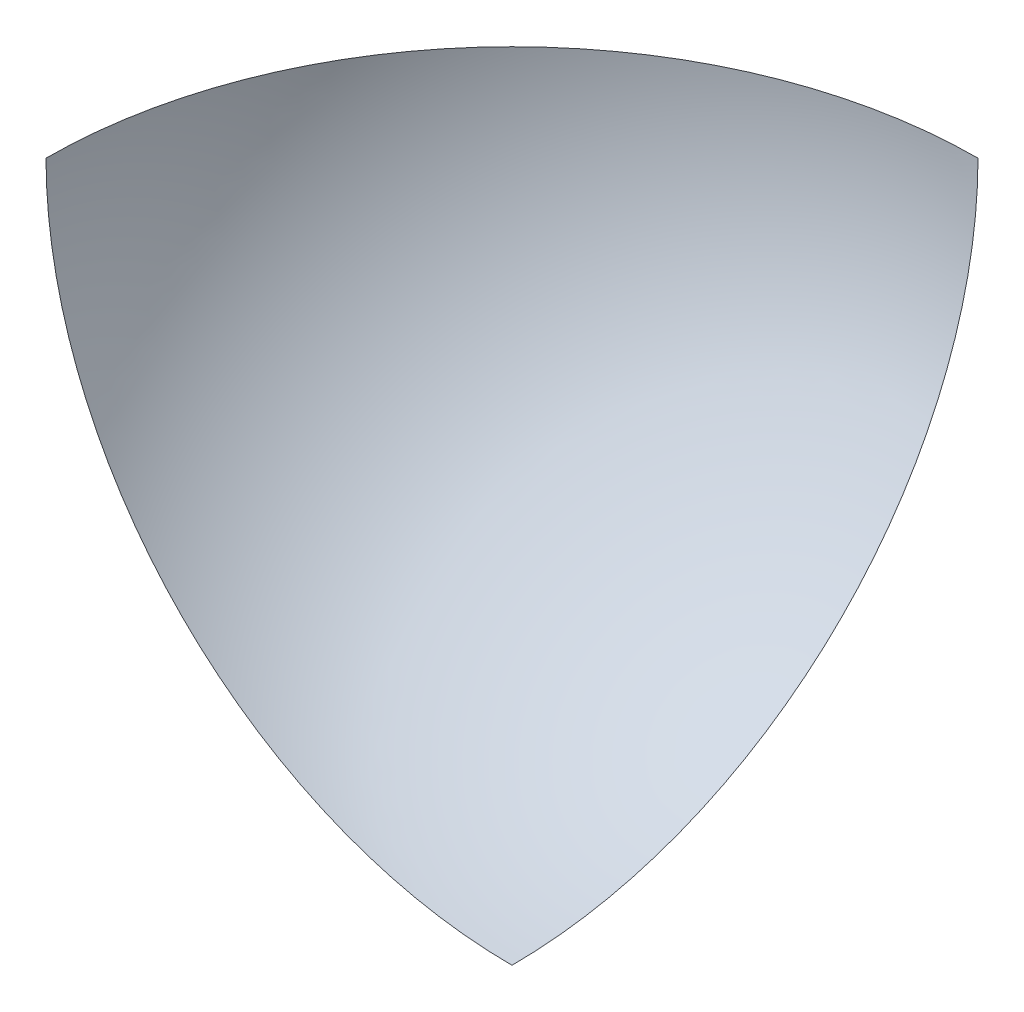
SolidWorks part; units mm, degrees
ref_plane "Front XY" through (0, 0, 0) normal (0, 0, 1) x (1, 0, 0)
ref_plane "Top XZ" through (0, 0, 0) normal (0, 1, 0) x (1, 0, 0)
ref_plane "Right YZ" through (0, 0, 0) normal (1, 0, 0) x (0, 0, -1)
sketch "Sketch1" plane through (0, 0, 0) normal (0, 0, 1) x (1, 0, 0)
  line L1 (0, 0) -> (25.4, 0)
  line L2 (0, 0) -> (0, 25.4)
  line L3 (0, 25.4) -> (25.4, 25.4)
  line L4 (25.4, 0) -> (25.4, 25.4)
  dimension "D1" = 25.4
extrude "Extrude1" add sketch "Sketch1" along normal blind 25.4
fillet "Fillet1" radius 12.7 12 edges at (25.4, 12.7, 25.4) (12.7, 25.4, 25.4) (0, 12.7, 25.4) (12.7, 25.4, 0) (25.4, 12.7, 0) (12.7, 0, 0) (0, 12.7, 0) (12.7, 0, 25.4) (0, 25.4, 12.7) (25.4, 25.4, 12.7) (25.4, 0, 12.7) (0, 0, 12.7)
other "DeleteFace1"
